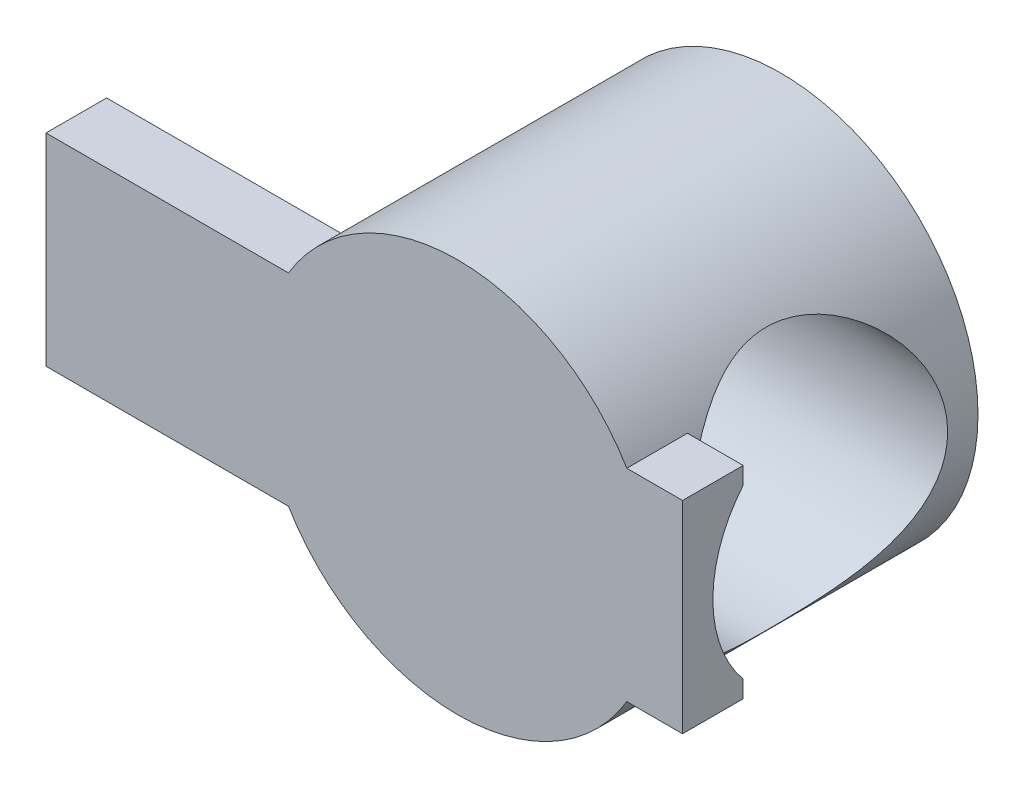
SolidWorks part; units mm, degrees
ref_plane "前视基准面" through (0, 0, 0) normal (0, 0, 1) x (1, 0, 0)
ref_plane "上视基准面" through (0, 0, 0) normal (0, 1, 0) x (1, 0, 0)
ref_plane "右视基准面" through (0, 0, 0) normal (1, 0, 0) x (0, 0, -1)
sketch "草图1" plane through (0, 0, 0) normal (0, 0, 1) x (1, 0, 0)
  circle A0 centre (0, 0) radius 9.75
extrude "凸台-拉伸1" add sketch "草图1" along normal mid plane 16
sketch "草图2" plane through (0, 0, 8) normal (0, 0, 1) x (1, 0, 0)
  line L0 (0, 11.9519) -> (0, -13.3741) construction
  line L4 (-8.3703, 5) -> (-20.3703, 5)
  line L5 (-20.3703, 5) -> (-20.3703, -5)
  line L6 (-20.3703, -5) -> (-8.3703, -5)
  circle A1 centre (0, 0) radius 9.75 construction
  arc A2 (-8.3703, 5) -> (-8.3703, -5) centre (0, 0) ccw
  dimension "D1" = 10
  dimension "D3" = 12
extrude "凸台-拉伸2" add sketch "草图2" against normal blind 3 contours L6 A2 L4 L5
sketch "草图4" plane through (0, 0, 8) normal (0, 0, 1) x (1, 0, 0)
  line L0 (-20.3703, 5) -> (-20.3703, -5) construction
  line L1 (8.3703, 5) -> (11.1297, 5)
  line L2 (11.1297, 5) -> (11.1297, -5)
  line L3 (11.1297, -5) -> (8.3703, -5)
  arc A0 (-8.3703, -5) -> (-8.3703, 5) centre (0, 0) ccw construction
  arc A1 (8.3703, 5) -> (8.3703, -5) centre (0, 0) cw
  dimension "D1" = 31.5
extrude "凸台-拉伸3" add sketch "草图4" against normal blind 3
sketch "草图5" plane through (0, 0, 0) normal (1, 0, 0) x (0, 0, -1)
  circle A0 centre (0, 0) radius 4.25
  dimension "D1" = 8.5
extrude "切除-拉伸1" cut sketch "草图5" against normal mid plane 30
sketch "草图6" plane through (0, 0, 0) normal (1, 0, 0) x (0, 0, -1)
  circle A0 centre (0, 0) radius 6.5
  dimension "D1" = 13
extrude "切除-拉伸2" cut sketch "草图6" along normal blind 17
sketch "草图7" plane through (0, 0, 0) normal (1, 0, 0) x (0, 0, -1)
  circle A0 centre (0, 0) radius 6.5
extrude "切除-拉伸3" cut sketch "草图7" against normal blind 3
